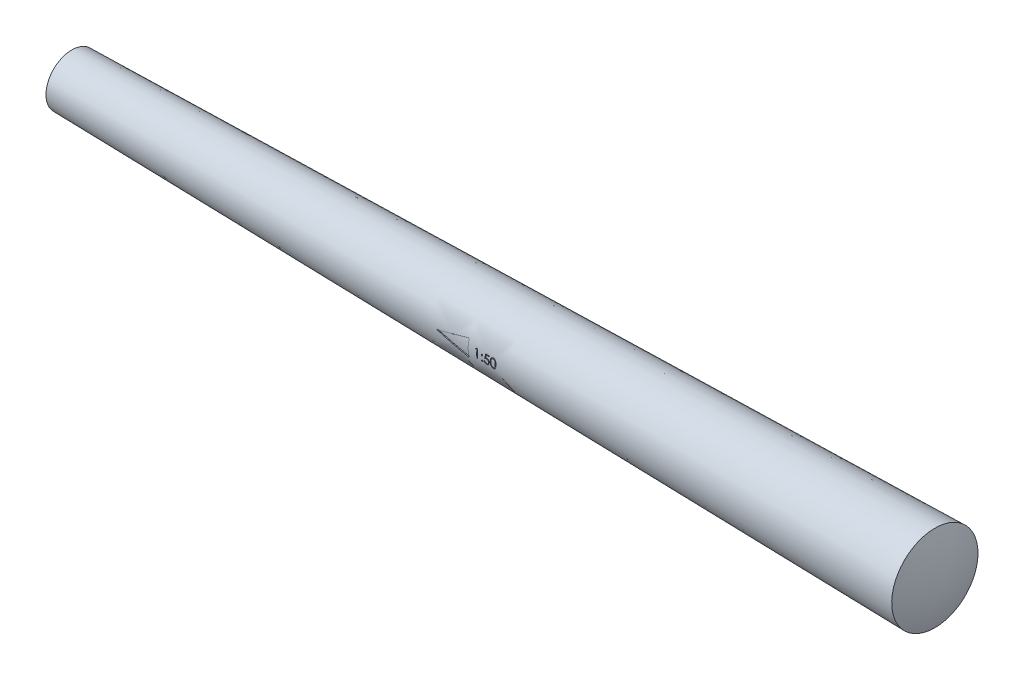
SolidWorks part; units mm, degrees
ref_plane "Front Plane" through (0, 0, 0) normal (0, 0, 1) x (1, 0, 0)
ref_plane "Top Plane" through (0, 0, 0) normal (0, 1, 0) x (1, 0, 0)
ref_plane "Right Plane" through (0, 0, 0) normal (1, 0, 0) x (0, 0, -1)
sketch "Sketch1" plane through (0, 0, 0) normal (1, 0, 0) x (0, 0, -1)
  circle A0 centre (0, 0) radius 3
  dimension "D1" = 6
extrude "Extrude1" add sketch "Sketch1" along normal mid plane 100
draft "Draft1" type of draft neutral plane draft angle 1.146 faces to draft 1 parameters "D1"=1.146
sketch "Sketch2" plane through (0, 0, 0) normal (0, 0, 1) x (1, 0, 0)
  line L0 (-50, 0) -> (-50, 3)
  line L1 (-50, 3) -> (-50, -3) construction
  line L2 (-50, 0) -> (-50.9, 0)
  line L3 (-50.9, 0) -> (-50.9, -4) construction
  line L4 (50, 0) -> (50, 5.0001)
  line L5 (50, -5.0001) -> (50, 5.0001) construction
  line L6 (50, 0) -> (50.9, 0)
  line L7 (50.9, 0) -> (50.9, -4) construction
  line L8 (-50, -3) -> (50, -5.0001) construction
  arc A0 (-50.9, 0) -> (-50, 3) centre (-45.45, 0) cw
  arc A1 (50.9, 0) -> (50, 5.0001) centre (36.5608, 0) ccw
  point P14 (0, -4)
revolve "Revolve1" add sketch "Sketch2" angle 360 about L2
sketch "Sketch5" plane through (0, 0, 0) normal (0, 0, 1) x (1, 0, 0)
  line L0 (0, 4) -> (0, -4) construction
  line L1 (50, 5.0001) -> (-50, 3) construction
  line L2 (-50, -3) -> (50, -5.0001) construction
ref_plane "Plane2" through (0, 0, 0) normal (-0.02, 0, 0.9998) x (0.9998, 0, 0.02)
sketch "Sketch6" plane through (0, 0, 0) normal (-0.02, 0, 0.9998) x (0.9998, 0, 0.02)
  line L0 (0, 0) -> (0, 1)
  line L1 (0, 4) -> (0, -4) construction
  line L2 (0, 1) -> (-3.7321, 0)
  line L3 (-3.7321, 0) -> (0, -1)
  line L4 (0, -1) -> (0, 0)
  line L5 (0, -0.5) -> (4, -0.5) construction
  text T0 "1:50" font "Century Gothic" height 1
  dimension "D1" = 2
  dimension "D2" = 30
  dimension "D3" = 4
wrap "Wrap2" sketch "Sketch6" wrap type deboss source sketch "Sketch6" thickness 0.1 parameters "D1"=0.1
equation "\"D2@Sketch2\" = \"D1@Sketch2\""
